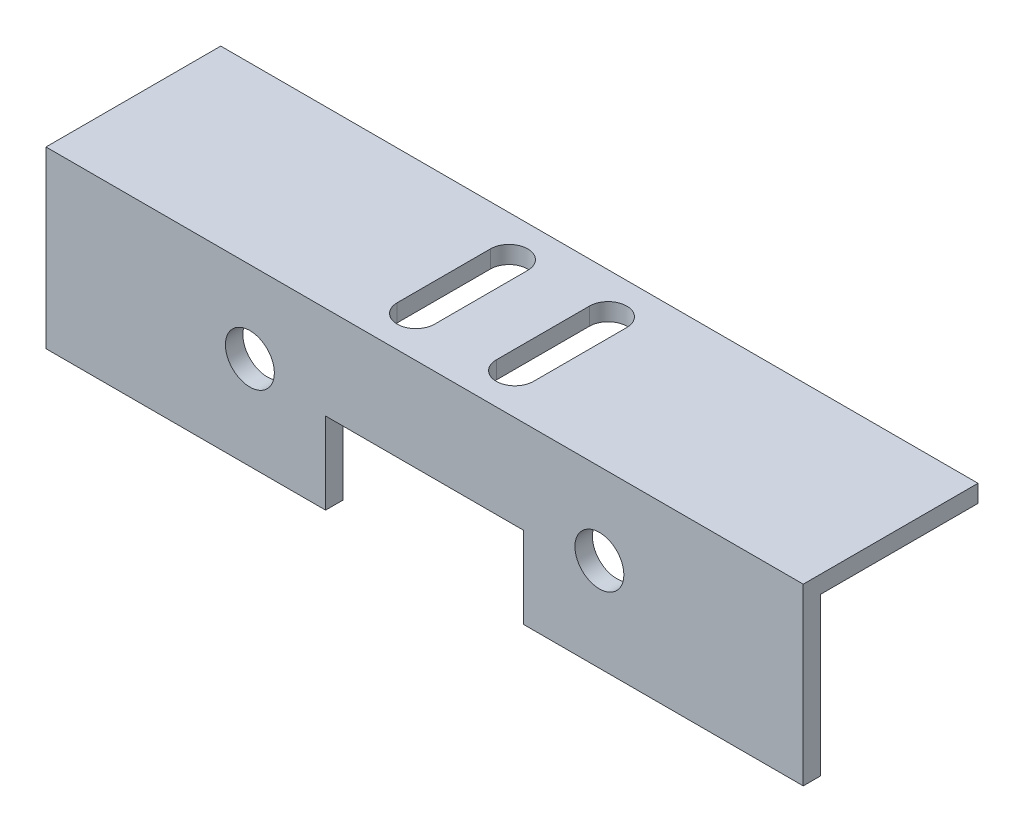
SolidWorks part; units mm, degrees
ref_plane "Спереди" through (0, 0, 0) normal (0, 0, 1) x (1, 0, 0)
ref_plane "Сверху" through (0, 0, 0) normal (0, 1, 0) x (1, 0, 0)
ref_plane "Справа" through (0, 0, 0) normal (1, 0, 0) x (0, 0, -1)
sketch "Эскиз1" plane through (0, 0, 0) normal (1, 0, 0) x (0, 0, -1)
  line L0 (0, 0) -> (0, 15)
  line L1 (0, 15) -> (15, 15)
  line L2 (15, 15) -> (15, 13.5)
  line L3 (15, 13.5) -> (1.5, 13.5)
  line L4 (1.5, 13.5) -> (1.5, 0)
  line L5 (1.5, 0) -> (0, 0)
  dimension "D1" = 1.5
  dimension "D2" = 1.5
  dimension "D3" = 15
  dimension "D4" = 15
extrude "Бобышка-Вытянуть1" add sketch "Эскиз1" along normal blind 65
sketch "Эскиз2" plane through (0, 0, 0) normal (0, 0, 1) x (1, 0, 0)
  line L0 (65, 15) -> (0, 15) construction
  line L2 (24, 7) -> (41, 7)
  line L3 (24, 7) -> (24, -10.969)
  line L4 (24, -10.969) -> (41, -10.969)
  line L5 (41, 7) -> (41, -10.969)
  circle A0 centre (17.5, 8) radius 2.1
  circle A1 centre (47.5, 8) radius 2.1
  point P6 (32.5, 15)
  point P11 (32.5, 7)
extrude "Вырез-Вытянуть1" cut sketch "Эскиз2" against normal through all
sketch "Эскиз3" plane through (0, 15, 0) normal (0, 1, 0) x (1, 0, 0)
  line L0 (28.25, 3.5) -> (28.25, 11.5) construction
  line L1 (26.65, 3.5) -> (26.65, 11.5)
  line L2 (29.85, 3.5) -> (29.85, 11.5)
  line L3 (36.75, 3.5) -> (36.75, 11.5) construction
  line L4 (35.15, 3.5) -> (35.15, 11.5)
  line L5 (38.35, 3.5) -> (38.35, 11.5)
  line L6 (0, 15) -> (0, 0) construction
  line L7 (65, 15) -> (0, 15) construction
  arc A0 (26.65, 3.5) -> (29.85, 3.5) centre (28.25, 3.5) ccw
  arc A1 (29.85, 11.5) -> (26.65, 11.5) centre (28.25, 11.5) ccw
  arc A2 (35.15, 3.5) -> (38.35, 3.5) centre (36.75, 3.5) ccw
  arc A3 (38.35, 11.5) -> (35.15, 11.5) centre (36.75, 11.5) ccw
  point P2 (28.25, 7.5)
  point P7 (36.75, 7.5)
  point P14 (0, 7.5)
  point P15 (32.5, 15)
extrude "Вырез-Вытянуть2" cut sketch "Эскиз3" against normal through all
equation "\"D4@Эскиз2\"=\"D2@Эскиз2\"/2"
equation "\"D6@Эскиз3\"=\"D5@Эскиз3\"/2"
